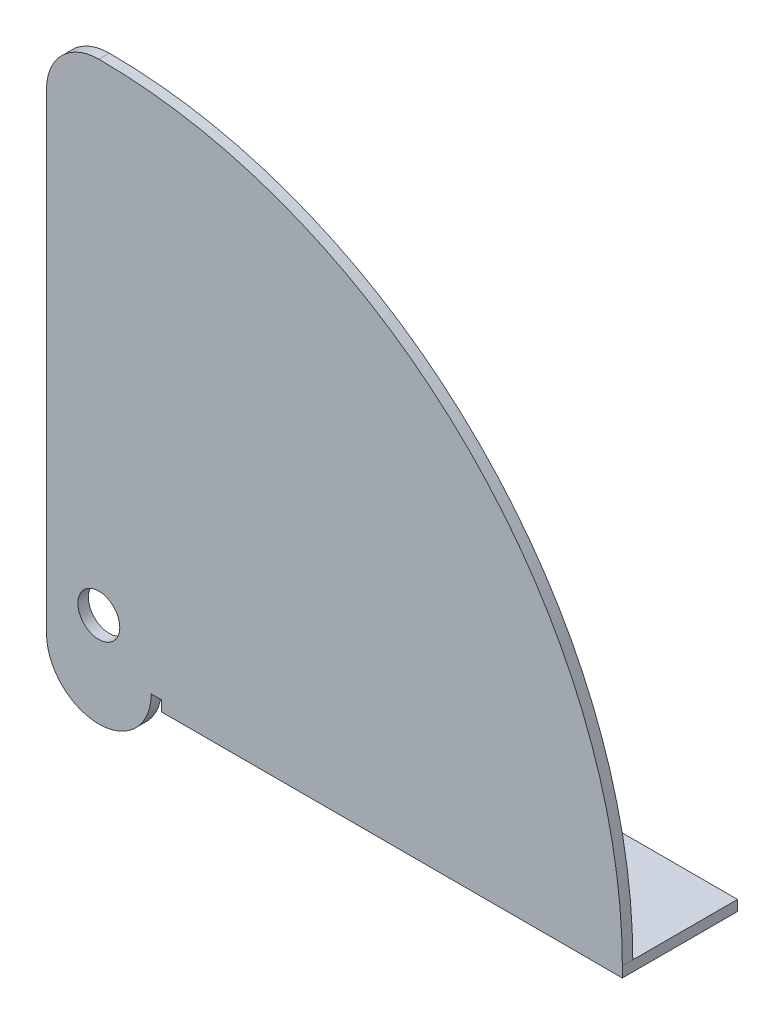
SolidWorks part; units mm, degrees
ref_plane "Front" through (0, 0, 0) normal (0, 0, 1) x (1, 0, 0)
ref_plane "Top" through (0, 0, 0) normal (0, 1, 0) x (1, 0, 0)
ref_plane "Right" through (0, 0, 0) normal (1, 0, 0) x (0, 0, -1)
sketch "Sketch1" plane through (0, 0, 0) normal (0, 0, 1) x (1, 0, 0)
  line L0 (5, 0) -> (50, 0)
  line L8 (-5, 0) -> (-5, 45)
  arc A0 (50, 0) -> (0, 50) centre (0, 0) ccw
  arc A2 (-5, 0) -> (5, 0) centre (0, 0) ccw
  arc A3 (0, 50) -> (-5, 45) centre (0, 45) ccw
  circle A4 centre (0, 4) radius 2
extrude "Extrude1" add sketch "Sketch1" along normal blind 1
sketch "Sketch5" plane through (0, 0, 0) normal (0, -1, 0) x (1, 0, 0)
  line L6 (50, 1) -> (50, -10)
  line L7 (50, -10) -> (6, -10)
  line L8 (6, 1) -> (6, -10)
  line L9 (50, 1) -> (6, 1)
  circle A2 centre (16, -5) radius 1.75
  circle A3 centre (40, -5) radius 1.75
extrude "Extrude3" add sketch "Sketch5" along normal blind 1
